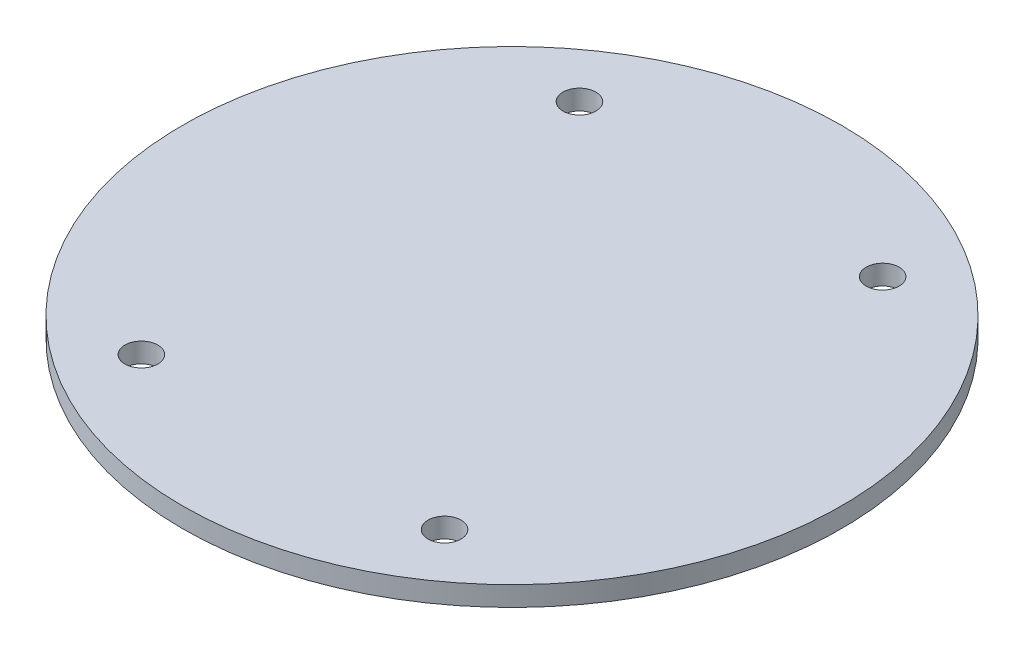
SolidWorks part; units mm, degrees
ref_plane "Front Plane" through (0, 0, 0) normal (0, 0, 1) x (1, 0, 0)
ref_plane "Top Plane" through (0, 0, 0) normal (0, 1, 0) x (1, 0, 0)
ref_plane "Right Plane" through (0, 0, 0) normal (1, 0, 0) x (0, 0, -1)
sketch "values-params_print" plane through (0, 0, 0) normal (0, 0, 1) x (1, 0, 0)
  line L0 (0, 0) -> (0.7, 0) construction
  line L1 (0, -5.2349) -> (3, -5.2349) construction
  line L2 (0, -10.104) -> (4, -10.104) construction
  line L3 (0, -15.1093) -> (100, -15.1093) construction
  line L4 (0, -19.837) -> (0.15, -19.837) construction
  line L5 (0, -24.2596) -> (0.3, -24.2596) construction
  line L6 (0, -28.606) -> (3.175, -28.606) construction
  line L7 (0, -33.0286) -> (9.5, -33.0286) construction
  line L8 (0, -37.6038) -> (2.4, -37.6038) construction
  line L9 (0, -43.1661) -> (6.35, -43.1661) construction
  dimension "width destroy" = 0.7
  dimension "width keep" = 3
  dimension "width tab" = 4
  dimension "base diameter" = 100
  dimension "print fit" = 0.15
  dimension "print free" = 0.3
  dimension "pin diameter" = 3.175
  dimension "pulley diameter" = 9.5
  dimension "pulley thickness" = 2.4
  dimension "base pin diameter" = 6.35
inserted part "params_print"
sketch "Sketch1" plane through (0, 0, 0) normal (0, 1, 0) x (1, 0, 0)
  circle A0 centre (0, 0) radius 50
  dimension "D1" = 100
extrude "Base" add sketch "Sketch1" along normal blind 3
sketch "Sketch2" plane through (0, 3, 0) normal (0, 1, 0) x (1, 0, 0)
  line L0 (0, 50) -> (0, -50) construction
  line L1 (0, 0) -> (-50, 0) construction
  line L2 (0, 0) -> (-35.3553, 35.3553) construction
  line L3 (-33.234, 33.234) -> (0, 33.234) construction
  circle A0 centre (0, 0) radius 50 construction
  circle A1 centre (0, 0) radius 47 construction
  circle A2 centre (-23, 33.234) radius 2.5
  circle A3 centre (23, 33.234) radius 2.5
  circle A4 centre (23, -33.234) radius 2.5
  circle A5 centre (-23, -33.234) radius 2.5
  dimension "D2" = 3
  dimension "D3" = 5
  dimension "D1" = 45
  dimension "D4" = 23
extrude "Supports" cut sketch "Sketch2" against normal through all
equation "\"D1@Sketch1\" = \"base diameter@values@params_print.sldprt\""
equation "\"D1@Base\" = \"width keep@values@params_print.sldprt\""
equation "\"D2@Sketch2\" = \"width keep@values@params_print.sldprt\""
